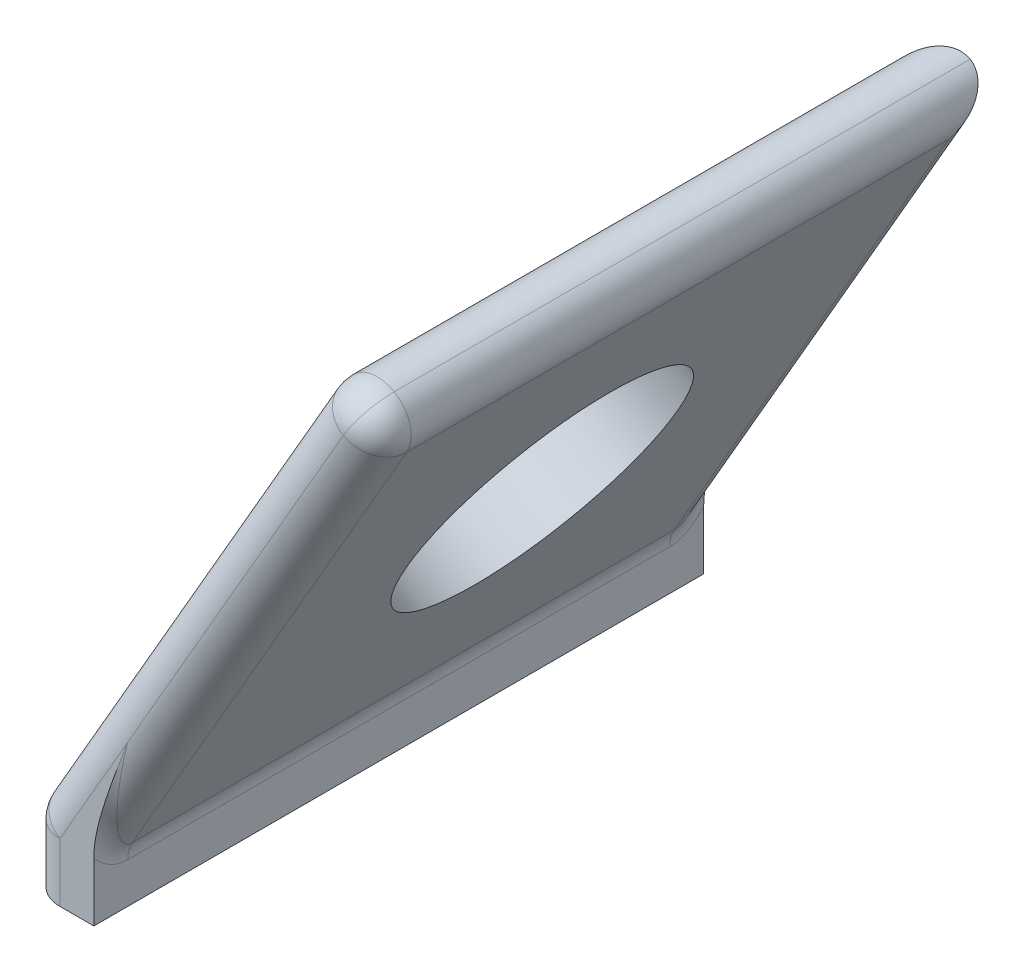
SolidWorks part; units mm, degrees
ref_plane "Plan de face" through (0, 0, 0) normal (0, 0, 1) x (1, 0, 0)
ref_plane "Plan de dessus" through (0, 0, 0) normal (0, 1, 0) x (1, 0, 0)
ref_plane "Plan de droite" through (0, 0, 0) normal (1, 0, 0) x (0, 0, -1)
sketch "Esquisse1" plane through (0, 0, 0) normal (0, 0, 1) x (1, 0, 0)
  line L0 (0, 0) -> (0, 1)
  line L1 (0, 1) -> (4.5, 8.7942)
  line L2 (4.5, 8.7942) -> (5.366, 8.2942)
  line L3 (5.366, 8.2942) -> (1, 0.7321)
  line L4 (1, 0.7321) -> (1, 0)
  line L5 (1, 0) -> (0, 0)
  dimension "D1" = 1
  dimension "D2" = 1
  dimension "D3" = 9
  dimension "D4" = 1
  dimension "D5" = 210
  dimension "D6" = 90
extrude "Boss.-Extru.1" add sketch "Esquisse1" against normal blind 9
sketch "Esquisse2" plane through (-0.433, 0.25, 0) normal (-0.866, 0.5, 0) x (0, 0, 1)
  line L0 (-9, 9.866) -> (-9, 0.866) construction
  line L1 (-9, 9.866) -> (0, 9.866) construction
  circle A0 centre (-4.5, 5.366) radius 2
  point P4 (-4.5, 9.866)
  dimension "D1" = 4.5
  dimension "D2" = 4
  dimension "D3" = 4.5
extrude "Enlèv. mat.-Extru.1" cut sketch "Esquisse2" against normal through all
fillet "Congé1" radius 0.5 6 edges at (3.183, 4.5131, -9) (5.366, 8.2942, -4.5) (3.183, 4.5131, 0) (2.25, 4.8971, -9) (4.5, 8.7942, -4.5) (2.25, 4.8971, 0)
fillet "Congé2" radius 0.5 6 edges at (1, 1.0249, -8.8536) (1, 1.0249, -0.1464) (0, 0.7071, -8.8536) (0, 0.7071, -0.1464) (1, 0.7321, -4.5) (0, 1, -4.5)
